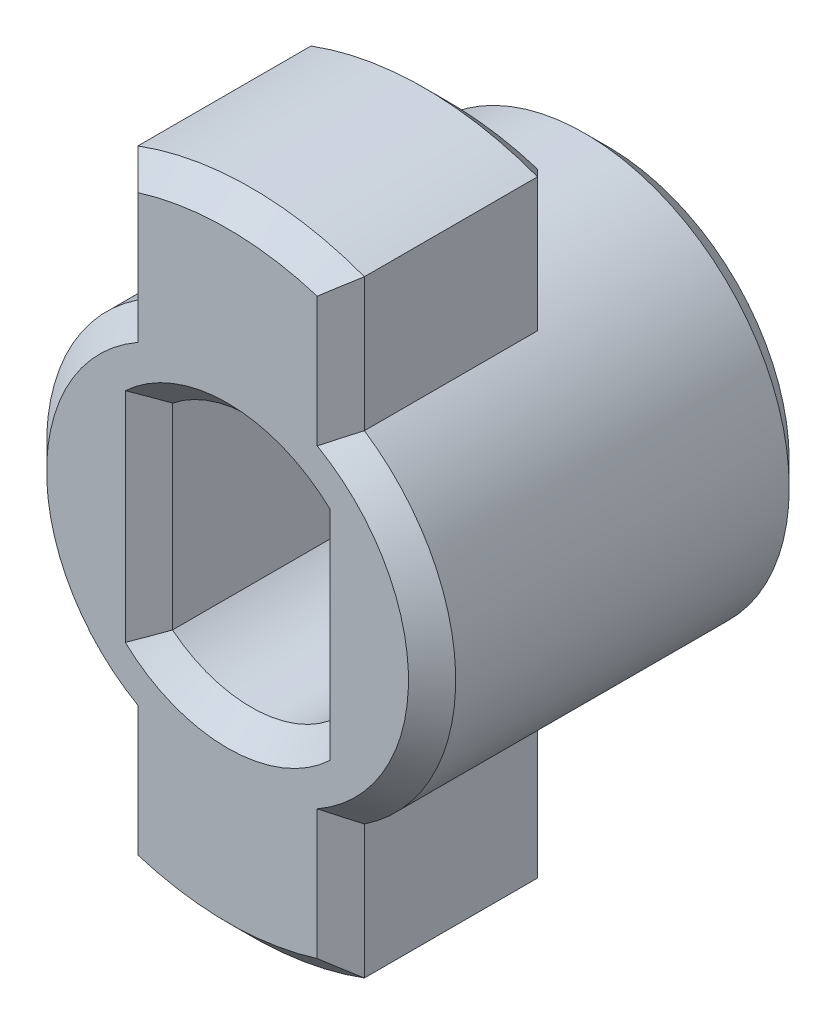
SolidWorks part; units mm, degrees
ref_plane "Plan1" through (0, 0, 0) normal (0, 0, 1) x (1, 0, 0)
ref_plane "Plan2" through (0, 0, 0) normal (0, 1, 0) x (1, 0, 0)
ref_plane "Plan3" through (0, 0, 0) normal (1, 0, 0) x (0, 0, -1)
sketch "Esquisse1" plane through (0, 0, 0) normal (0, 0, 1) x (1, 0, 0)
  line L2 (-2.5, 3.1225) -> (-2.5, -3.1225) construction
  line L3 (2.5, -3.1225) -> (2.5, 3.1225) construction
  line L4 (-2.5, 3.1225) -> (-2.5, -3.1225)
  line L5 (21, 0) -> (-21, 0) construction
  line L6 (2.5, -3.1225) -> (2.5, 3.1225)
  arc A2 (-2.5, -3.1225) -> (2.5, -3.1225) centre (0, 0) ccw construction
  arc A3 (2.5, 3.1225) -> (-2.5, 3.1225) centre (0, 0) ccw construction
  arc A4 (-2.5, -3.1225) -> (2.5, -3.1225) centre (0, 0) ccw
  arc A5 (2.5, 3.1225) -> (-2.5, 3.1225) centre (0, 0) ccw
  circle A6 centre (0, 0) radius 6.5
  dimension "D1" = 13
extrude "Base-Extrusion" add sketch "Esquisse1" along normal blind 12.1
sketch "Esquisse2" plane through (0, 0, 12.1) normal (0, 0, 1) x (1, 0, 0)
  line L0 (-3.6, 9.6504) -> (-3.6, 5.412)
  line L1 (12, 0) -> (-13, 0) construction
  line L2 (0, 11.1856) -> (0, -14) construction
  line L3 (3.6, -5.412) -> (3.6, -9.6504)
  line L4 (3.6, 9.6504) -> (3.6, 5.412)
  line L5 (-3.6, -5.412) -> (-3.6, -9.6504)
  arc A1 (3.6, 9.6504) -> (-3.6, 9.6504) centre (0, 0) ccw
  arc A2 (3.6, 5.412) -> (-3.6, 5.412) centre (0, 0) ccw
  arc A3 (-3.6, -9.6504) -> (3.6, -9.6504) centre (0, 0) ccw
  arc A4 (-3.6, -5.412) -> (3.6, -5.412) centre (0, 0) ccw
  dimension "D1" = 20.6
  dimension "D3" = 13
  dimension "D2" = 3.6
extrude "Boss.-Extru.1" add sketch "Esquisse2" against normal blind 7
chamfer "Chanfrein2" distance 0.75 angle 45
